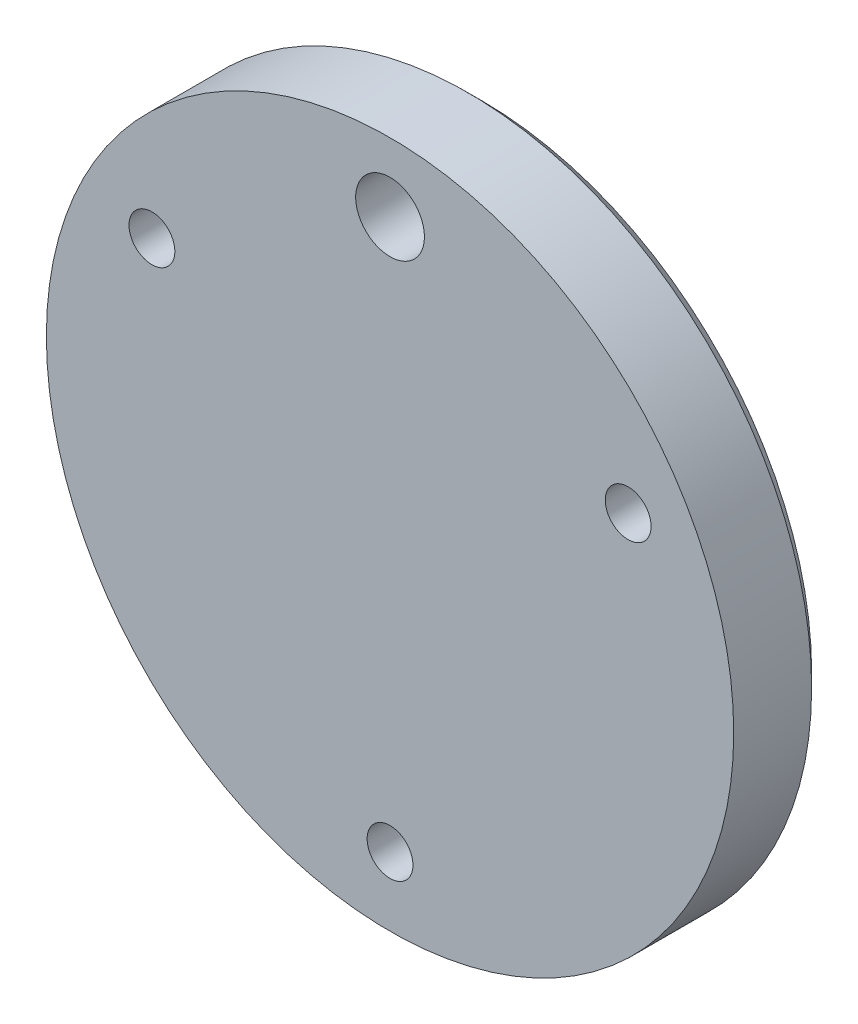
SolidWorks part; units mm, degrees
ref_plane "Ebene vorne" through (0, 0, 0) normal (0, 0, 1) x (1, 0, 0)
ref_plane "Ebene oben" through (0, 0, 0) normal (0, 1, 0) x (1, 0, 0)
ref_plane "Ebene rechts" through (0, 0, 0) normal (1, 0, 0) x (0, 0, -1)
sketch "Skizze1" plane through (0, 0, 0) normal (0, 0, 1) x (1, 0, 0)
  circle A0 centre (0, 0) radius 7.5
  dimension "D1" = 15
extrude "Linear austragen1" add sketch "Skizze1" along normal blind 2
sketch "Skizze2" plane through (0, 0, 0) normal (0, 0, -1) x (-1, 0, 0)
  line L0 (0, 0) -> (0, 7.9315) construction
  circle A0 centre (0, 6) radius 0.75
  dimension "D1" = 1.5
  dimension "D2" = 6
extrude "Schnitt-Linear austragen1" cut sketch "Skizze2" against normal up to next
sketch "Skizze3" plane through (0, 0, 0) normal (0, 0, -1) x (-1, 0, 0)
  line L0 (0, 0) -> (0, -7.7674) construction
  line L1 (0, 0) -> (5.1962, 3) construction
  circle A0 centre (0, -6) radius 0.5
  circle A1 centre (-5.1962, 3) radius 0.5
  circle A2 centre (5.1962, 3) radius 0.5
  dimension "D1" = 1
  dimension "D2" = 6
  dimension "D3" = 120
  dimension "D4" = 6
extrude "Schnitt-Linear austragen2" cut sketch "Skizze3" against normal blind 2
chamfer "Fase1" distance 0.3 angle 45 1 edges at (7.5, 0, 0)
chamfer "Fase2" distance 0.1 angle 45 4 edges at (-0.5, -6, 0) (4.6962, 3, 0) (-0.75, 6, 0) (-5.6962, 3, 0)
